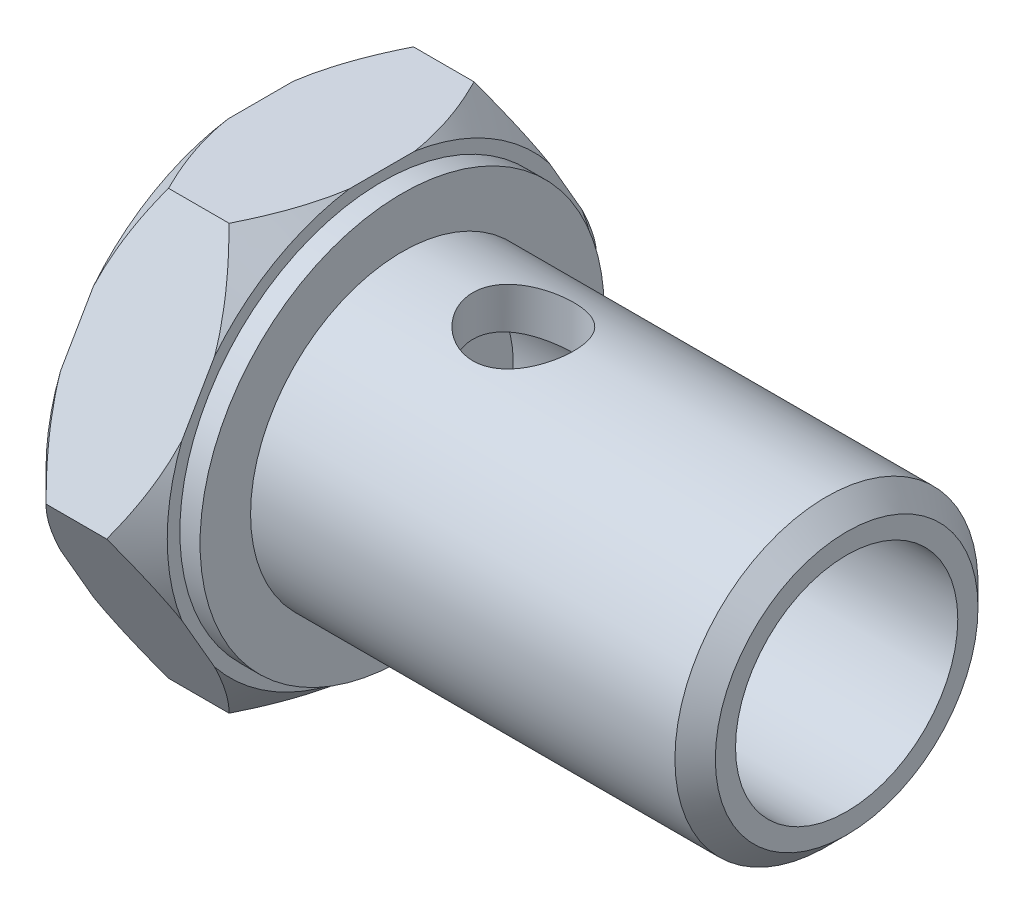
SolidWorks part; units mm, degrees
ref_plane "Front" through (0, 0, 0) normal (0, 0, 1) x (1, 0, 0)
ref_plane "Top" through (0, 0, 0) normal (0, 1, 0) x (1, 0, 0)
ref_plane "Right" through (0, 0, 0) normal (1, 0, 0) x (0, 0, -1)
sketch "Sketch2" plane through (0, 0, 0) normal (1, 0, 0) x (0, 0, -1)
  circle A0 centre (0, 0) radius 7.5
  circle A1 centre (0, 0) radius 5.5
  dimension "D1" = 15
  dimension "D2" = 2
extrude "Boss-Extrude1" add sketch "Sketch2" along normal blind 22
chamfer "Chamfer1" distance 1 angle 45 1 edges at (22, 0, -7.5)
sketch "Sketch3" plane through (0, 0, 0) normal (-1, 0, 0) x (0, 0, 1)
  circle A0 centre (0, 0) radius 10
  dimension "D1" = 20
extrude "Boss-Extrude2" add sketch "Sketch3" along normal blind 1
sketch "Sketch4" plane through (-1, 0, 0) normal (-1, 0, 0) x (0, 0, 1)
  line L1 (12.1244, 0) -> (6.0622, 10.5)
  line L2 (6.0622, 10.5) -> (-6.0622, 10.5)
  line L3 (-6.0622, 10.5) -> (-12.1244, 0)
  line L4 (-12.1244, 0) -> (-6.0622, -10.5)
  line L5 (-6.0622, -10.5) -> (6.0622, -10.5)
  line L6 (6.0622, -10.5) -> (12.1244, 0)
  circle A0 centre (0, 0) radius 10.5 construction
  dimension "D1" = 21
extrude "Boss-Extrude3" add sketch "Sketch4" along normal blind 6
sketch "Sketch5" plane through (0, 0, 0) normal (0, 1, 0) x (1, 0, 0)
  line L4 (-7, 10.6244) -> (-5.5, 12.1244)
  line L6 (-7, 6.0622) -> (-7, 12.1244) construction
  line L7 (-7, 12.1244) -> (-1, 12.1244) construction
  line L8 (-5.5, 12.1244) -> (-7, 12.1244)
  line L9 (0, 0) -> (-8.7824, 0) construction
  line L10 (-7, 12.1244) -> (-7, 10.6244)
  line L11 (-4, 12.1244) -> (-4, 13.0888) construction
  line L12 (-1, 12.1244) -> (-1, 10.6244)
  line L13 (-2.5, 12.1244) -> (-1, 12.1244)
  line L14 (-1, 10.6244) -> (-2.5, 12.1244)
  dimension "D1" = 45
  dimension "D2" = 1.5
revolve "Cut-Revolve2" cut sketch "Sketch5" angle 360 about L9
sketch "Sketch6" plane through (0, 0, 0) normal (0, 1, 0) x (1, 0, 0)
  circle A0 centre (6, 0) radius 2.5
  dimension "D1" = 5
  dimension "D2" = 6
extrude "Cut-Extrude1" cut sketch "Sketch6" against normal through all and the other way through all
